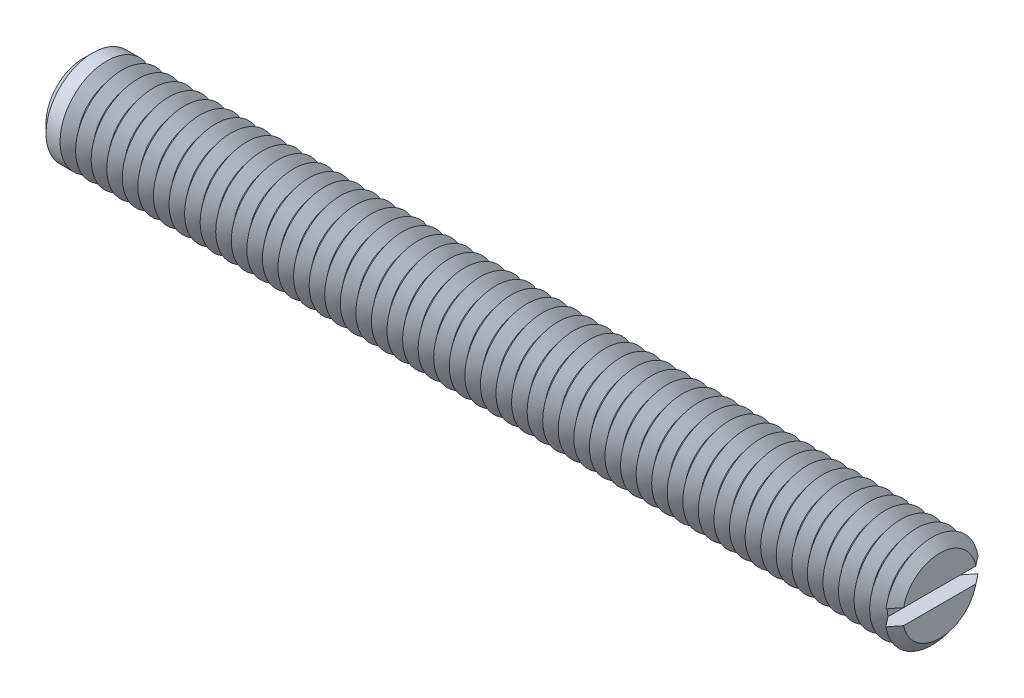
SolidWorks part; units mm, degrees
ref_plane "Front Plane" through (0, 0, 0) normal (0, 0, 1) x (1, 0, 0)
ref_plane "Top Plane" through (0, 0, 0) normal (0, 1, 0) x (1, 0, 0)
ref_plane "Right Plane" through (0, 0, 0) normal (1, 0, 0) x (0, 0, -1)
sketch "Sketch1" plane through (0, 0, 0) normal (1, 0, 0) x (0, 0, -1)
  circle A0 centre (0, 0) radius 3
  dimension "D1" = 6
extrude "Extrude1" add sketch "Sketch1" along normal mid plane 55
sketch "Sketch2" plane through (0, 0, 0) normal (0, 0, 1) x (1, 0, 0)
  line L0 (27.5, 0.5) -> (26.5, 0.5)
  line L1 (27.5, -3) -> (27.5, 3) construction
  line L2 (26.5, 0.5) -> (26.5, -0.5)
  line L3 (0, 0) -> (50000, 0) construction
  line L4 (27.5, -0.5) -> (26.5, -0.5)
  line L5 (27.5, -0.5) -> (27.5, 0.5)
  point P9 (26.5, 0)
  dimension "D1" = 1
extrude "Extrude2" cut sketch "Sketch2" against normal mid plane 9
chamfer "Chamfer1" distance 0.6 angle 45 1 edges at (-27.5, 0, -3)
sketch "Sketch3" plane through (0, 0, 0) normal (0, 0, 1) x (1, 0, 0)
  line L0 (0, 0) -> (30.9602, 0) construction
  line L1 (27, -3) -> (28, -3)
  line L2 (-26.9, -3) -> (27.5, -3) construction
  line L3 (28, -3) -> (27.5, -2.3755)
  line L4 (27.5, -3) -> (27.5, -0.5) construction
  line L5 (27.5, -2.3755) -> (27, -3)
  dimension "D1" = 1
  dimension "D2" = 0.8
revolve "Cut-Revolve1" cut sketch "Sketch3" angle 360 about L0
pattern_linear "LPattern1" count 54 spacing 1 along (-1, 0, 0) of "Cut-Revolve1"
equation "\"D2@Sketch3\" = \"D1@Sketch3\"*0.8"
